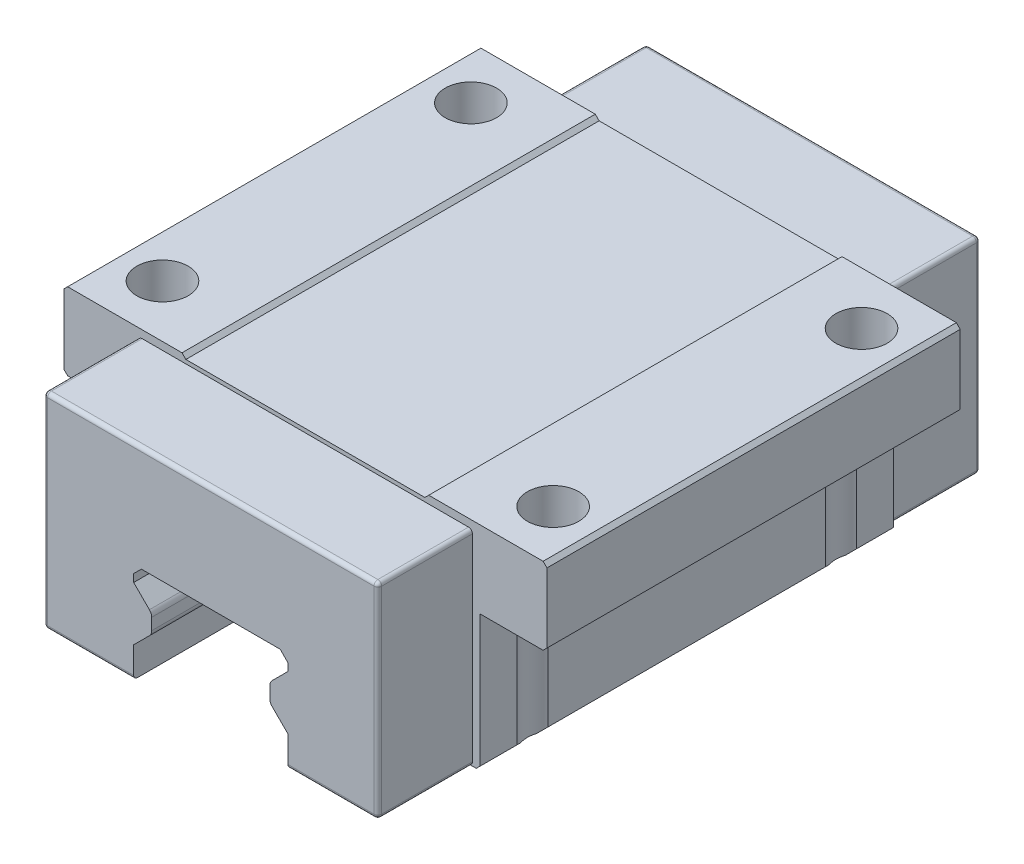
SolidWorks part; units mm, degrees
ref_plane "Front Plane" through (0, 0, 0) normal (0, 0, 1) x (1, 0, 0)
ref_plane "Top Plane" through (0, 0, 0) normal (0, 1, 0) x (1, 0, 0)
ref_plane "Right Plane" through (0, 0, 0) normal (1, 0, 0) x (0, 0, -1)
sketch "Sketch1" plane through (0, 0, 0) normal (0, 0, 1) x (1, 0, 0)
  line L1 (-17, 3.3) -> (17, 3.3)
  line L2 (-17, 3.3) -> (-17, 24)
  line L3 (-17, 24) -> (17, 24)
  line L4 (17, 3.3) -> (17, 24)
  line L5 (-17, 3.3) -> (17, 24) construction
  line L6 (-17, 24) -> (17, 3.3) construction
  point P0 (0, 13.65)
  dimension "D1" = 24
  dimension "D2" = 3.3
  dimension "D3" = 34
extrude "Boss-Extrude1" add sketch "Sketch1" along normal mid plane 40.2
sketch "Sketch2" plane through (0, 0, 0) normal (0, 0, 1) x (1, 0, 0)
  line L0 (-17, 3.3) -> (17, 3.3) construction
  line L1 (-16.25, 3.3) -> (16.25, 3.3)
  line L2 (-16.25, 3.3) -> (-16.25, 23.25)
  line L3 (-16.25, 23.25) -> (16.25, 23.25)
  line L4 (16.25, 3.3) -> (16.25, 23.25)
  line L5 (-16.25, 23.25) -> (-17, 23.25) construction
  line L6 (-17, 24) -> (-17, 3.3) construction
  line L7 (16.25, 23.25) -> (16.25, 24) construction
  line L8 (17, 24) -> (-17, 24) construction
  line L9 (16.25, 23.25) -> (17, 23.25) construction
  line L10 (17, 3.3) -> (17, 24) construction
  point P9 (0, 23.25)
  dimension "D1" = 0.75
extrude "Boss-Extrude2" add sketch "Sketch2" along normal mid plane 58.6
sketch "Sketch3" plane through (0, 0, 29.3) normal (0, 0, 1) x (1, 0, 0)
  line L1 (-7.5, 13) -> (7.5, 13)
  line L2 (-7.5, 13) -> (-7.5, 0)
  line L3 (-7.5, 0) -> (7.5, 0)
  line L4 (7.5, 13) -> (7.5, 0)
  line L5 (-7.5, 13) -> (7.5, 0) construction
  line L6 (-7.5, 0) -> (7.5, 13) construction
  point P0 (0, 6.5)
  dimension "D1" = 15
  dimension "D2" = 13
extrude "Cut-Extrude1" cut sketch "Sketch3" against normal through all
sketch "Sketch4" plane through (0, 0, 29.3) normal (0, 0, 1) x (1, 0, 0)
  line L0 (-7.5, 11.5) -> (-7.5, 6.25)
  line L1 (-7.5, 13) -> (-7.5, 3.3) construction
  line L2 (-7.5, 6.25) -> (-5.75, 8)
  line L3 (-5.75, 8) -> (-5.75, 9.75)
  line L4 (-5.75, 9.75) -> (-7.5, 11.5)
  line L5 (7.5, 13) -> (-7.5, 13) construction
  line L6 (-5.75, 9.75) -> (-7.5, 9.75) construction
  line L7 (-5.75, 8) -> (-7.5, 8) construction
  line L8 (-6.625, 9.75) -> (-6.625, 8) construction
  line L9 (0, 0) -> (0, 13) construction
  line L10 (6.625, 9.75) -> (6.625, 8) construction
  line L11 (5.75, 8) -> (7.5, 8) construction
  line L12 (5.75, 9.75) -> (7.5, 9.75) construction
  line L13 (5.75, 9.75) -> (7.5, 11.5)
  line L14 (5.75, 8) -> (5.75, 9.75)
  line L15 (7.5, 6.25) -> (5.75, 8)
  line L16 (7.5, 11.5) -> (7.5, 6.25)
extrude "Boss-Extrude3" add sketch "Sketch4" against normal up to surface (58.6 mm away)
chamfer "Chamfer1" distance 0.75 angle 45 2 edges at (7.5, 13, 0) (-7.5, 13, 0)
fillet "Fillet1" radius 0.75 4 edges at (5.75, 8, 0) (5.75, 9.75, 0) (-5.75, 8, 0) (-5.75, 9.75, 0)
sketch "Sketch5" plane through (0, 0, 20.1) normal (0, 0, 1) x (1, 0, 0)
  line L0 (17, 24) -> (-17, 24) construction
  line L1 (-12, 24) -> (12, 24)
  line L2 (-12, 24) -> (-12, 23.625)
  line L3 (-12, 23.625) -> (12, 23.625)
  line L4 (12, 24) -> (12, 23.625)
  point P6 (0, 23.625)
  dimension "D1" = 24
  dimension "D2" = 0.375
extrude "Cut-Extrude2" cut sketch "Sketch5" against normal through all
chamfer "Chamfer2" distance 0.375 angle 45 6 edges at (17, 24, 0) (17, 3.3, 0) (-17, 3.3, 0) (-17, 24, 0) (12, 23.625, 0) (-12, 23.625, 0)
fillet "Fillet2" radius 0.375 18 edges at (-16.25, 3.3, -24.7) (11.875, 3.3, -29.3) (-16.25, 3.3, 24.7) (-11.875, 3.3, 29.3) (11.875, 3.3, 29.3) (16.25, 3.3, 24.7) (-16.25, 13.275, 29.3) (-16.25, 23.25, 24.7) (16.25, 23.25, 24.7) (16.25, 13.275, 29.3) (0, 23.25, 29.3) (16.25, 3.3, -24.7) (16.25, 13.275, -29.3) (16.25, 23.25, -24.7) (-16.25, 23.25, -24.7) (-11.875, 3.3, -29.3) (-16.25, 13.275, -29.3) (0, 23.25, -29.3)
sketch "Sketch7" plane through (0, 0, 0) normal (0, 0, 1) x (1, 0, 0)
  line L0 (-16.625, 24) -> (-23.5, 24)
  line L1 (-23.5, 24) -> (-23.5, 16.5)
  line L2 (-16.625, 24) -> (-16.625, 10.375)
  line L3 (-17, 23.625) -> (-17, 3.675) construction
  line L4 (-17, 10.375) -> (-16.625, 10.375)
  line L5 (-23.5, 16.5) -> (-23.125, 16.5)
  line L6 (0, 0) -> (0, 23.625) construction
  line L7 (-11.625, 23.625) -> (11.625, 23.625) construction
  line L8 (23.5, 16.5) -> (23.125, 16.5)
  line L9 (17, 10.375) -> (16.625, 10.375)
  line L10 (16.625, 24) -> (16.625, 10.375)
  line L11 (23.5, 24) -> (23.5, 16.5)
  line L12 (16.625, 24) -> (23.5, 24)
  arc A1 (-23.125, 16.5) -> (-17, 10.375) centre (-23.125, 10.375) cw
  arc A2 (23.125, 16.5) -> (17, 10.375) centre (23.125, 10.375) ccw
  point P22 (-23.3125, 16.5)
  dimension "D1" = 47
  dimension "D2" = 7.5
  dimension "D3" = 0.375
extrude "Boss-Extrude4" add sketch "Sketch7" along normal mid plane 19.8
sketch "Sketch8" plane through (0, 0, 0) normal (0, 0, 1) x (1, 0, 0)
  line L0 (-23.5, 16.5) -> (-23.5, 24)
  line L9 (23.5, 16.5) -> (23.5, 24)
  line L10 (23.5, 16.5) -> (16.625, 16.5)
  line L11 (23.5, 24) -> (16.625, 24)
  line L13 (16.625, 24) -> (16.625, 16.5)
  line L14 (-23.5, 16.5) -> (-16.25, 16.5)
  line L15 (-23.5, 24) -> (-16.25, 24)
  line L16 (-16.25, 16.5) -> (-16.25, 24)
  line L17 (-16.25, 22.875) -> (-16.25, 3.675) construction
extrude "Boss-Extrude5" add sketch "Sketch8" along normal mid plane 40.2
chamfer "Chamfer3" distance 0.375 angle 45 4 edges at (-23.5, 16.5, 0) (-23.5, 24, 0) (23.5, 16.5, 0) (23.5, 24, 0)
fillet "Fillet3" radius 4 4 edges at (-17, 13.4375, 9.9) (-17, 13.4375, -9.9) (17, 13.4375, -9.9) (17, 13.4375, 9.9)
sketch "Sketch6" plane through (0, 24, 0) normal (0, 1, 0) x (1, 0, 0)
  line L1 (0, 0) -> (19, -15) construction
  line L3 (0, 0) -> (-19, -15) construction
  circle A1 centre (-19, -15) radius 2.5
  circle A2 centre (19, -15) radius 2.5
  dimension "D1" = 5
  dimension "D2" = 38
  dimension "D3" = 15
extrude "Cut-Extrude3" cut sketch "Sketch6" against normal blind 21
mirror "Mirror1" about plane through (0, 0, 0) normal (0, 0, 1) of "Cut-Extrude3"
equation "\"D2@Sketch4\"=\"D1@Sketch4\"*3.5"
